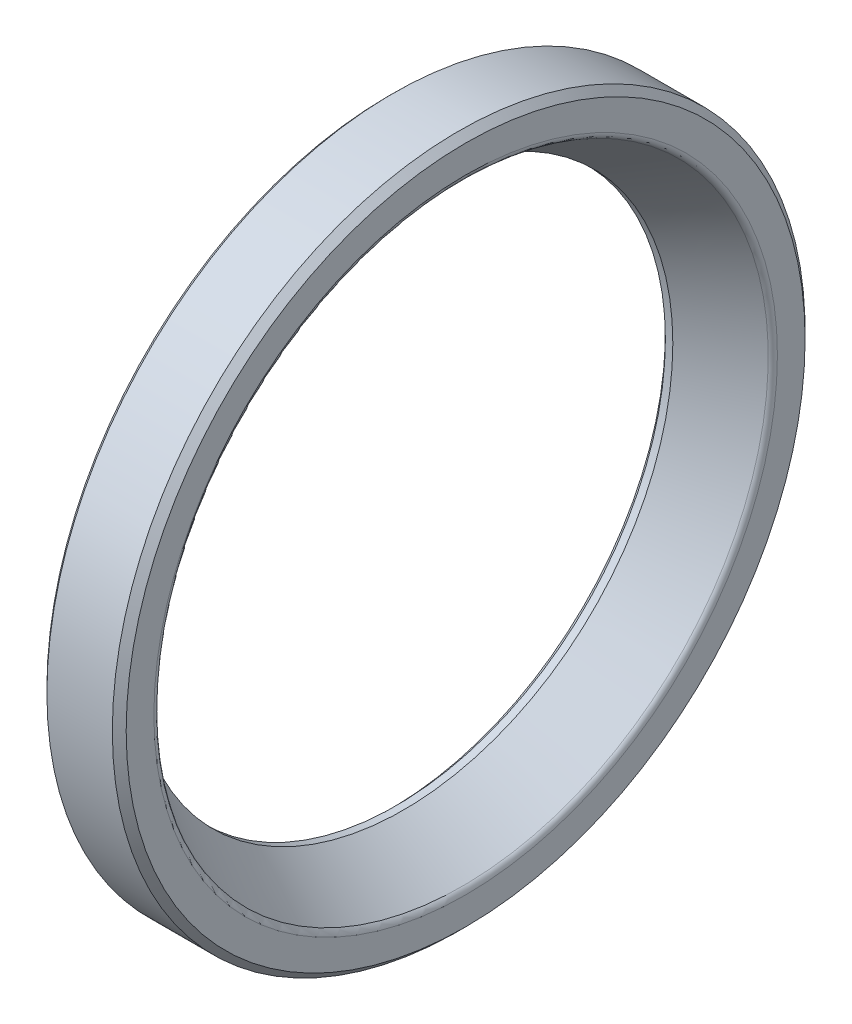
SolidWorks part; units mm, degrees
ref_plane "Plan de face" through (0, 0, 0) normal (0, 0, 1) x (1, 0, 0)
ref_plane "Plan de dessus" through (0, 0, 0) normal (0, 1, 0) x (1, 0, 0)
ref_plane "Plan de droite" through (0, 0, 0) normal (1, 0, 0) x (0, 0, -1)
sketch "Esquisse1" plane through (0, 0, 0) normal (0, 0, 1) x (1, 0, 0)
  line L0 (0, 44.4) -> (0, 42.8727)
  line L1 (0, 42.8727) -> (0.6, 42.2727)
  line L2 (0.6, 42.2727) -> (6.8, 42.2727)
  line L3 (7, 42.0727) -> (7, 40.059)
  line L4 (6.9484, 39.9715) -> (2.4757, 37.5)
  line L5 (1.3576, 37.5) -> (0.25, 37.5)
  line L6 (0.25, 37.5) -> (0.25, 35.7)
  line L7 (0.25, 35.7) -> (0.95, 35)
  line L8 (0.95, 35) -> (1.9167, 35)
  line L9 (1.9167, 35) -> (9.5734, 39.7362)
  line L10 (10, 40.5016) -> (10, 44.1)
  line L11 (10, 44.1) -> (9.1, 45)
  line L12 (9.1, 45) -> (0.6, 45)
  line L13 (0.6, 45) -> (0, 44.4)
  line L14 (10, 0) -> (0, 0) construction
  arc A0 (6.8, 42.2727) -> (7, 42.0727) centre (6.8, 42.0727) cw
  arc A1 (7, 40.059) -> (6.9484, 39.9715) centre (6.9, 40.059) cw
  arc A2 (2.4757, 37.5) -> (1.3576, 37.5) centre (1.9167, 37) ccw
  arc A3 (9.5734, 39.7362) -> (10, 40.5016) centre (9.1, 40.5016) ccw
revolve "Révolution1" add sketch "Esquisse1" angle 360 about L14
sketch "Esquisse2" plane through (10, 0, 0) normal (1, 0, 0) x (0, 0, -1)
  line L1 (-53.1124, 0) -> (57.3293, 0)
  line L2 (-53.1124, 0) -> (-53.1124, -59.4378)
  line L3 (-53.1124, -59.4378) -> (57.3293, -59.4378)
  line L4 (57.3293, 0) -> (57.3293, -59.4378)
extrude "Enlèv. mat.-Extru.1" [suppressed] cut sketch "Esquisse2" against normal through all
